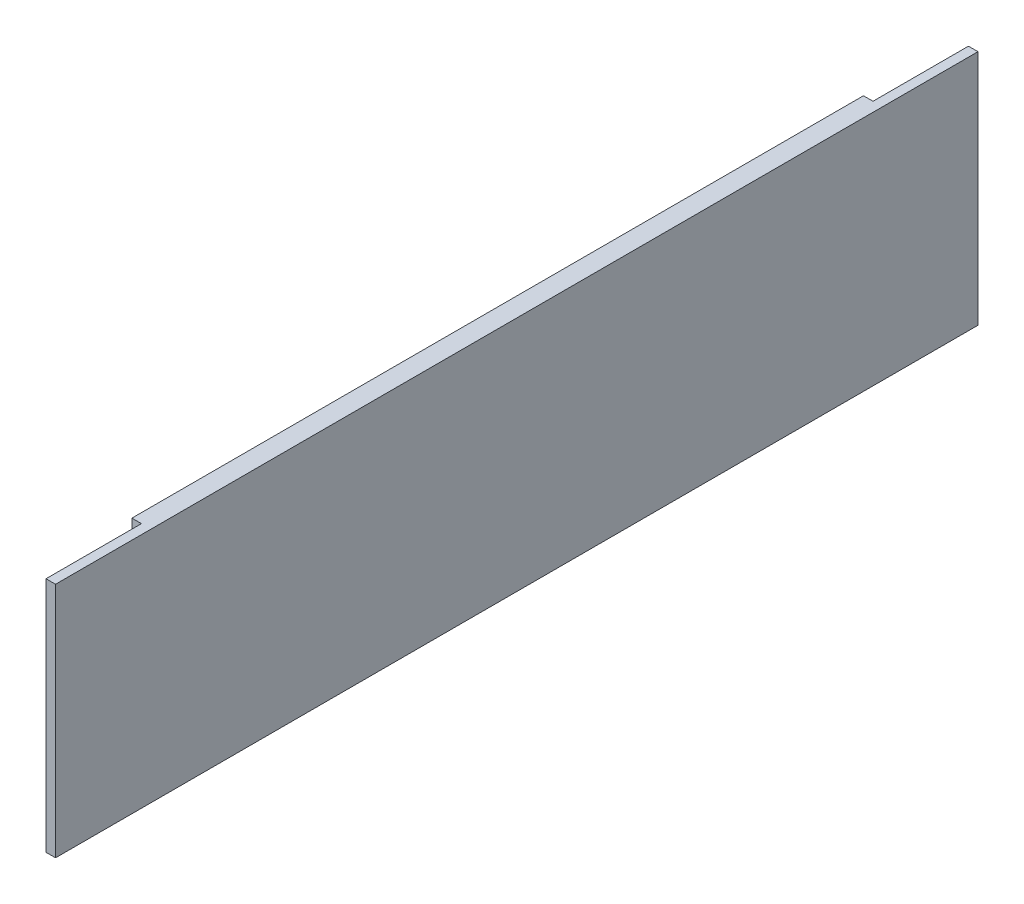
SolidWorks part; units mm, degrees
ref_plane "前视基准面" through (0, 0, 0) normal (0, 0, 1) x (1, 0, 0)
ref_plane "上视基准面" through (0, 0, 0) normal (0, 1, 0) x (1, 0, 0)
ref_plane "右视基准面" through (0, 0, 0) normal (1, 0, 0) x (0, 0, -1)
sketch "草图1" plane through (0, 68.0247, 0) normal (0, 1, 0) x (1, 0, 0)
  line L0 (-116.3024, -1950) -> (-116.3024, -1820) construction
  line L1 (-116.3024, -2110) -> (-119.3024, -2110)
  line L2 (-116.3024, -2110) -> (-116.3024, -1820)
  line L3 (-116.3024, -1820) -> (-119.3024, -1820)
  line L4 (-119.3024, -2110) -> (-119.3024, -1820)
  line L5 (-116.3024, -1820) -> (-119.3024, -1820) construction
  line L6 (-119.3024, -2110) -> (-116.3024, -2110) construction
  point P8 (-117.8024, -2110)
  dimension "D1" = 3
  dimension "D2" = 0
  dimension "D3" = 0
  dimension "D4" = 0
extrude "凸台-拉伸1" add sketch "草图1" along normal up to surface (74.4927 mm away)
sketch "草图2" plane through (0, 83.0247, 0) normal (0, 1, 0) x (1, 0, 0)
  line L5 (-119.3024, -2110) -> (-119.3024, -1820) construction
  line L6 (-122.3024, -1850) -> (-119.3024, -1850)
  line L7 (-122.3024, -1850) -> (-122.3024, -2080)
  line L8 (-122.3024, -2080) -> (-119.3024, -2080)
  line L9 (-119.3024, -1850) -> (-119.3024, -2080)
  line L10 (-122.3024, -2080) -> (-119.3024, -2080) construction
extrude "凸台-拉伸2" add sketch "草图2" along normal up to surface (59.4927 mm away)
